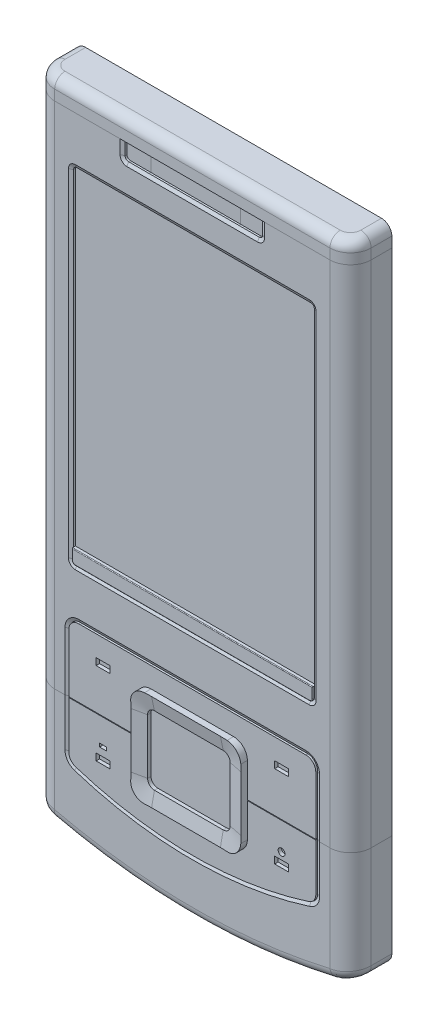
SolidWorks part; units mm, degrees
ref_plane "Front Plane" through (0, 0, 0) normal (0, 0, 1) x (1, 0, 0)
ref_plane "Top Plane" through (0, 0, 0) normal (0, 1, 0) x (1, 0, 0)
ref_plane "Right Plane" through (0, 0, 0) normal (1, 0, 0) x (0, 0, -1)
sketch "Sketch1" plane through (0, 0, 0) normal (0, 0, 1) x (1, 0, 0)
  line L0 (0, -93) -> (46, -93) construction
  line L1 (0, 0) -> (46, 0)
  line L2 (0, 0) -> (0, -93)
  line L3 (23, -96) -> (23, 0) construction
  line L4 (46, 0) -> (46, -93)
  arc A0 (0, -93) -> (46, -93) centre (23, -6.3333) ccw
  point P1 (46, -96)
  point P2 (0, -96)
  dimension "D1" = 46
  dimension "D2" = 96
  dimension "D3" = 3
extrude "Extrude1" add sketch "Sketch1" along normal blind 6
sketch "Sketch2" plane through (0, 0, 6) normal (0, 0, 1) x (1, 0, 0)
  line L0 (0, -3) -> (46, -3)
  line L1 (0, 0) -> (0, -93) construction
  line L2 (46, -93) -> (46, 0) construction
  line L3 (0, -77) -> (46, -77)
  line L4 (46, 0) -> (0, 0) construction
  arc A0 (0, -93) -> (46, -93) centre (23, -6.3333) ccw construction
  point P8 (23, -96)
  dimension "D1" = 19
  dimension "D2" = 3
split "Split1" trim tools "Sketch2" bodies to split 101 resulting bodies 102 103 104
sketch "Sketch3" plane through (0, 0, 6) normal (0, 0, 1) x (1, 0, 0)
  line L0 (0, -3) -> (0, -77) construction
  line L1 (6.5, -67) -> (39.5, -67)
  line L2 (5, -68.5) -> (5, -83.9174)
  line L3 (23, -77) -> (23, -88) construction
  line L4 (41, -68.5) -> (41, -83.9174)
  line L6 (0, -77) -> (46, -77) construction
  line L7 (5, -85) -> (41, -85) construction
  line L8 (0, -77) -> (46, -77) construction
  arc A0 (6.0417, -85.3457) -> (39.9583, -85.3457) centre (23, -32.5) ccw
  arc A1 (6.5, -67) -> (5, -68.5) centre (6.5, -68.5) ccw
  arc A2 (6.0417, -85.3457) -> (5, -83.9174) centre (6.5, -83.9174) cw
  arc A3 (39.9583, -85.3457) -> (41, -83.9174) centre (39.5, -83.9174) ccw
  arc A4 (39.5, -67) -> (41, -68.5) centre (39.5, -68.5) cw
  point P1 (41, -88)
  point P2 (5, -88)
  point P17 (5, -67)
  point P26 (41, -67)
  dimension "D3" = 11
  dimension "D6" = 1.5
  dimension "D1" = 36
  dimension "D2" = 5
  dimension "D4" = 10
  dimension "D5" = 3
extrude "Extrude2" cut sketch "Sketch3" against normal blind 2
sketch "Sketch5" plane through (0, 0, 4) normal (0, 0, 1) x (1, 0, 0)
  line L39 (40.95, -76.95) -> (40.95, -68.5)
  line L40 (39.5, -67.05) -> (6.5, -67.05)
  line L41 (5.05, -68.5) -> (5.05, -76.95)
  line L42 (5.05, -76.95) -> (40.95, -76.95)
  line L43 (40.95, -76.95) -> (40.95, -68.5)
  line L44 (39.5, -67.05) -> (6.5, -67.05)
  line L45 (5.05, -68.5) -> (5.05, -76.95)
  line L46 (5.05, -76.95) -> (40.95, -76.95)
  line L49 (40.95, -77.05) -> (5.05, -77.05)
  line L50 (5.05, -77.05) -> (5.05, -83.9174)
  line L51 (40.95, -83.9174) -> (40.95, -77.05)
  line L52 (40.95, -77.05) -> (5.05, -77.05)
  line L53 (5.05, -77.05) -> (5.05, -83.9174)
  line L54 (40.95, -83.9174) -> (40.95, -77.05)
  arc A2 (40.95, -68.5) -> (39.5, -67.05) centre (39.5, -68.5) ccw
  arc A3 (40.95, -68.5) -> (39.5, -67.05) centre (39.5, -68.5) ccw
  arc A4 (6.0569, -85.2981) -> (39.9431, -85.2981) centre (23, -32.5) ccw
  arc A5 (6.0569, -85.2981) -> (39.9431, -85.2981) centre (23, -32.5) ccw
  arc A6 (6.5, -67.05) -> (5.05, -68.5) centre (6.5, -68.5) ccw
  arc A7 (6.5, -67.05) -> (5.05, -68.5) centre (6.5, -68.5) ccw
  arc A9 (5.05, -83.9174) -> (6.0569, -85.2981) centre (6.5, -83.9174) ccw
  arc A10 (5.05, -83.9174) -> (6.0569, -85.2981) centre (6.5, -83.9174) ccw
  arc A11 (39.9431, -85.2981) -> (40.95, -83.9174) centre (39.5, -83.9174) ccw
  arc A12 (39.9431, -85.2981) -> (40.95, -83.9174) centre (39.5, -83.9174) ccw
  dimension "D1" = 0.05
  dimension "D2" = 0.05
extrude "Extrude3" add sketch "Sketch5" along normal blind 2 separate body
sketch "Sketch6" plane through (0, 0, 6) normal (0, 0, 1) x (1, 0, 0)
  line L0 (5, -77) -> (5, -83.9174) construction
  line L1 (17, -70) -> (29, -70)
  line L2 (15, -72) -> (15, -82)
  line L3 (17, -84) -> (29, -84)
  line L4 (31, -72) -> (31, -82)
  line L5 (41, -83.9174) -> (41, -77) construction
  line L6 (39.5, -67) -> (6.5, -67) construction
  arc A0 (6.0417, -85.3457) -> (39.9583, -85.3457) centre (23, -32.5) ccw construction
  arc A1 (17, -70) -> (15, -72) centre (17, -72) ccw
  arc A2 (29, -70) -> (31, -72) centre (29, -72) cw
  arc A3 (29, -84) -> (31, -82) centre (29, -82) ccw
  arc A4 (15, -82) -> (17, -84) centre (17, -82) ccw
  point P10 (23, -88)
  dimension "D5" = 2
  dimension "D1" = 10
  dimension "D2" = 10
  dimension "D3" = 3
  dimension "D4" = 4
extrude "Extrude4" cut sketch "Sketch6" against normal blind 2
sketch "Sketch7" plane through (0, 0, 4) normal (0, 0, 1) x (1, 0, 0)
  line L1 (29, -70) -> (17, -70) construction
  line L2 (29, -70) -> (17, -70)
  line L3 (17, -84) -> (29, -84)
  line L4 (31, -82) -> (31, -72)
  line L5 (15, -72) -> (15, -82)
  line L6 (18, -72) -> (28, -72)
  line L7 (17, -73) -> (17, -81)
  line L8 (18, -82) -> (28, -82)
  line L9 (29, -73) -> (29, -81)
  arc A0 (17, -70) -> (15, -72) centre (17, -72) ccw construction
  arc A1 (17, -70) -> (15, -72) centre (17, -72) ccw
  arc A2 (31, -72) -> (29, -70) centre (29, -72) ccw construction
  arc A3 (31, -72) -> (29, -70) centre (29, -72) ccw
  arc A4 (15, -82) -> (17, -84) centre (17, -82) ccw construction
  arc A5 (15, -82) -> (17, -84) centre (17, -82) ccw
  arc A6 (29, -84) -> (31, -82) centre (29, -82) ccw construction
  arc A7 (29, -84) -> (31, -82) centre (29, -82) ccw
  arc A8 (18, -72) -> (17, -73) centre (18, -73) ccw
  arc A9 (28, -72) -> (29, -73) centre (28, -73) cw
  arc A10 (28, -82) -> (29, -81) centre (28, -81) ccw
  arc A11 (17, -81) -> (18, -82) centre (18, -81) ccw
  dimension "D1" = 1
extrude "Extrude5" add sketch "Sketch7" along normal blind 3 separate body
sketch "Sketch8" plane through (0, 0, 4) normal (0, 0, 1) x (1, 0, 0)
  line L0 (18, -72) -> (28, -72)
  line L1 (29, -73) -> (29, -81)
  line L2 (28, -82) -> (18, -82)
  line L3 (17, -81) -> (17, -73)
  line L4 (17, -73) -> (17, -81) construction
  line L5 (18, -82) -> (28, -82) construction
  line L6 (29, -81) -> (29, -73) construction
  line L7 (28, -72) -> (18, -72) construction
  arc A0 (18, -72) -> (17, -73) centre (18, -73) ccw
  arc A1 (18, -82) -> (17, -81) centre (18, -81) cw
  arc A2 (29, -81) -> (28, -82) centre (28, -81) cw
  arc A3 (28, -72) -> (29, -73) centre (28, -73) cw
  point P10 (17, -72)
  point P13 (17, -82)
  point P16 (29, -82)
  point P19 (29, -72)
  dimension "D1" = 1
extrude "Extrude6" add sketch "Sketch8" along normal blind 2 separate body
sketch "Sketch9" plane through (0, 0, 6) normal (0, 0, 1) x (1, 0, 0)
  line L0 (9.025, -70.05) -> (11.025, -70.05)
  line L1 (9.025, -83.05) -> (11.025, -83.05)
  line L6 (36.975, -83.05) -> (34.975, -83.05)
  line L15 (36.975, -70.05) -> (34.975, -70.05)
  line L19 (10.025, -76.95) -> (10.025, -67.05) construction
  line L20 (5.05, -76.95) -> (15, -76.95) construction
  line L21 (39.5, -67.05) -> (6.5, -67.05) construction
  line L22 (10.025, -77.05) -> (10.025, -86.462) construction
  line L23 (15, -77.05) -> (5.05, -77.05) construction
  line L24 (35.975, -76.95) -> (35.975, -67.05) construction
  line L25 (31, -76.95) -> (40.95, -76.95) construction
  line L26 (35.975, -77.05) -> (35.975, -86.4106) construction
  line L27 (40.95, -77.05) -> (31, -77.05) construction
  line L28 (9.025, -82.05) -> (11.025, -82.05)
  line L30 (36.975, -82.05) -> (34.975, -82.05)
  line L31 (9.025, -82.05) -> (9.025, -83.05)
  line L34 (9.025, -71.05) -> (11.025, -71.05)
  line L35 (34.975, -82.05) -> (34.975, -83.05)
  line L36 (11.025, -82.05) -> (11.025, -83.05)
  line L37 (36.975, -71.05) -> (34.975, -71.05)
  line L38 (11.025, -71.05) -> (11.025, -70.05)
  line L39 (36.975, -71.05) -> (36.975, -70.05)
  line L40 (36.975, -82.05) -> (36.975, -83.05)
  line L41 (9.025, -71.05) -> (9.025, -70.05)
  line L42 (34.975, -71.05) -> (34.975, -70.05)
  line L43 (9.525, -81.05) -> (10.525, -81.05)
  line L44 (5.05, -71.05) -> (15, -71.05) construction
  line L45 (5.05, -70.05) -> (15, -70.05) construction
  line L46 (9.025, -76.95) -> (9.025, -67.05) construction
  line L47 (11.025, -76.95) -> (11.025, -67.05) construction
  line L48 (40.95, -70.05) -> (31, -70.05) construction
  line L49 (40.95, -71.05) -> (31, -71.05) construction
  line L50 (36.975, -76.95) -> (36.975, -67.05) construction
  line L51 (34.975, -76.95) -> (34.975, -67.05) construction
  line L52 (11.025, -77.05) -> (11.025, -86.462) construction
  line L53 (9.025, -77.05) -> (9.025, -86.462) construction
  line L56 (40.95, -83.05) -> (31, -83.05) construction
  line L57 (40.95, -82.05) -> (31, -82.05) construction
  line L58 (34.975, -77.05) -> (34.975, -86.4106) construction
  line L59 (36.975, -77.05) -> (36.975, -86.4106) construction
  line L61 (9.525, -80.55) -> (10.525, -80.55)
  line L62 (9.525, -80.55) -> (9.525, -81.05)
  line L63 (10.525, -80.55) -> (10.525, -81.05)
  line L65 (9.525, -77.05) -> (9.525, -86.462) construction
  line L66 (9.025, -80.55) -> (11.025, -80.55) construction
  line L67 (9.025, -81.05) -> (11.025, -81.05) construction
  line L70 (10.525, -77.05) -> (10.525, -86.462) construction
  arc A0 (6.0417, -85.3457) -> (39.9583, -85.3457) centre (23, -32.5) ccw construction
  arc A1 (6.0569, -85.2981) -> (39.9431, -85.2981) centre (23, -32.5) ccw construction
  circle A2 centre (35.975, -81.05) radius 0.5
  point P16 (5.05, -83.05)
  point P17 (15, -83.05)
  point P24 (5.05, -82.05)
  point P25 (15, -82.05)
  dimension "D18" = 1
  dimension "D19" = 1
  dimension "D3" = 3
  dimension "D4" = 3
  dimension "D1" = 6
  dimension "D2" = 1
  dimension "D9" = 6
  dimension "D5" = 1
  dimension "D6" = 1
  dimension "D7" = 1
  dimension "D8" = 1
  dimension "D10" = 1
  dimension "D11" = 1
  dimension "D12" = 1
  dimension "D13" = 1
  dimension "D15" = 0.5
  dimension "D16" = 0.5
  dimension "D17" = 0.5
extrude "Extrude7" cut sketch "Sketch9" against normal blind 0.5
sketch "Sketch10" plane through (0, 0, 6) normal (0, 0, 1) x (1, 0, 0)
  line L0 (0, -3) -> (46, -3) construction
  line L1 (13, -3) -> (33, -3)
  line L2 (13, -3) -> (13, -5)
  line L3 (13.5, -5.5) -> (32.5, -5.5)
  line L4 (33, -3) -> (33, -5)
  line L5 (0, -3) -> (0, -77) construction
  arc A0 (13, -5) -> (13.5, -5.5) centre (13.5, -5) ccw
  arc A1 (32.5, -5.5) -> (33, -5) centre (32.5, -5) ccw
  point P10 (13, -5.5)
  point P13 (33, -5.5)
  dimension "D4" = 0.5
  dimension "D1" = 2.5
  dimension "D2" = 20
  dimension "D3" = 13
extrude "Extrude8" cut sketch "Sketch10" against normal blind 0.5
sketch "Sketch12" plane through (0, 0, 5.5) normal (0, 0, 1) x (1, 0, 0)
  line L0 (13, -3) -> (13, -5) construction
  line L1 (13, -3) -> (13, -5)
  line L2 (13.5, -5.5) -> (16.5, -5.5)
  line L3 (13.5, -5.5) -> (32.5, -5.5) construction
  line L4 (16.5, -5.5) -> (16.5, -3)
  line L5 (33, -3) -> (13, -3) construction
  line L6 (16.5, -3) -> (13, -3)
  line L7 (33, -5) -> (33, -3) construction
  line L8 (33, -5) -> (33, -3)
  line L9 (33, -3) -> (29.5, -3)
  line L10 (0, -3) -> (46, -3) construction
  line L11 (29.5, -3) -> (29.5, -5.5)
  line L12 (13.5, -5.5) -> (32.5, -5.5) construction
  line L13 (29.5, -5.5) -> (32.5, -5.5)
  arc A0 (13, -5) -> (13.5, -5.5) centre (13.5, -5) ccw construction
  arc A1 (13, -5) -> (13.5, -5.5) centre (13.5, -5) ccw
  arc A2 (32.5, -5.5) -> (33, -5) centre (32.5, -5) ccw construction
  arc A3 (32.5, -5.5) -> (33, -5) centre (32.5, -5) ccw
  dimension "D1" = 3.5
  dimension "D2" = 3.5
extrude "Extrude9" cut sketch "Sketch12" against normal blind 2
sketch "Sketch13" plane through (0, 0, 3.5) normal (0, 0, 1) x (1, 0, 0)
  line L0 (16.5, -3) -> (13, -3) construction
  line L1 (16.5, -5.5) -> (16.5, -3) construction
  line L2 (33, -3) -> (29.5, -3) construction
  line L3 (29.5, -3) -> (29.5, -5.5) construction
  circle A0 centre (14.75, -4.25) radius 1
  circle A1 centre (31.25, -4.25) radius 1
  dimension "D1" = 2
  dimension "D2" = 1.25
  dimension "D3" = 1.75
  dimension "D4" = 2
  dimension "D5" = 1.25
  dimension "D6" = 1.75
extrude "Extrude10" add sketch "Sketch13" along normal blind 1 separate body
sketch "Sketch14" plane through (0, 0, 4.5) normal (0, 0, 1) x (1, 0, 0)
  line L0 (13, -3) -> (16.5, -3)
  line L1 (16.5, -3) -> (16.5, -5.5)
  line L2 (16.5, -5.5) -> (13.5, -5.5)
  line L3 (13, -5) -> (13, -3)
  line L4 (32.5, -5.5) -> (29.5, -5.5)
  line L5 (29.5, -5.5) -> (29.5, -3)
  line L6 (29.5, -3) -> (33, -3)
  line L7 (33, -3) -> (33, -5)
  arc A0 (13.5, -5.5) -> (13, -5) centre (13.5, -5) cw
  arc A1 (33, -5) -> (32.5, -5.5) centre (32.5, -5) cw
extrude "Extrude11" add sketch "Sketch14" along normal blind 1 separate body
chamfer "Chamfer1" distance 0.5 angle 25 10 edges at (41, -72.75, 6) (5, -72.75, 6) (40.5607, -67.4393, 6) (5.4393, -67.4393, 6) (23, -67, 6) (33, -4, 6) (32.8536, -5.3536, 6) (23, -5.5, 6) (13.1464, -5.3536, 6) (13, -4, 6)
chamfer "Chamfer2" distance 0.5 angle 25 5 edges at (41, -80.4587, 6) (40.7119, -84.8013, 6) (23, -88, 6) (5.2881, -84.8013, 6) (5, -80.4587, 6)
sketch "Sketch15" plane through (0, 0, 6) normal (0, 0, 1) x (1, 0, 0)
  line L0 (46, 0) -> (0, 0) construction
  line L1 (6, -10) -> (40, -10)
  line L2 (5.5, -10.5) -> (5.5, -59.5)
  line L3 (6, -60) -> (40, -60)
  line L4 (40.5, -10.5) -> (40.5, -59.5)
  line L5 (0, -3) -> (0, -77) construction
  arc A0 (6, -10) -> (5.5, -10.5) centre (6, -10.5) ccw
  arc A1 (40, -10) -> (40.5, -10.5) centre (40, -10.5) cw
  arc A2 (40, -60) -> (40.5, -59.5) centre (40, -59.5) ccw
  arc A3 (5.5, -59.5) -> (6, -60) centre (6, -59.5) ccw
  point P10 (5.5, -10)
  point P13 (40.5, -10)
  point P18 (5.5, -60)
  dimension "D5" = 0.5
  dimension "D1" = 50
  dimension "D2" = 35
  dimension "D3" = 10
  dimension "D4" = 5.5
extrude "Extrude12" cut sketch "Sketch15" against normal blind 1
sketch "Sketch16" plane through (0, 0, 5) normal (0, 0, 1) x (1, 0, 0)
  line L4 (5.5, -10.5) -> (5.5, -59.5)
  line L5 (6, -60) -> (40, -60)
  line L6 (40.5, -59.5) -> (40.5, -10.5)
  line L7 (40, -10) -> (6, -10)
  line L8 (5.5, -10.5) -> (5.5, -59.5)
  line L9 (6, -60) -> (40, -60)
  line L10 (40.5, -59.5) -> (40.5, -10.5)
  line L11 (40, -10) -> (6, -10)
  arc A4 (6, -10) -> (5.5, -10.5) centre (6, -10.5) ccw
  arc A5 (6, -10) -> (5.5, -10.5) centre (6, -10.5) ccw
  arc A6 (5.5, -59.5) -> (6, -60) centre (6, -59.5) ccw
  arc A7 (5.5, -59.5) -> (6, -60) centre (6, -59.5) ccw
  arc A8 (40, -60) -> (40.5, -59.5) centre (40, -59.5) ccw
  arc A9 (40, -60) -> (40.5, -59.5) centre (40, -59.5) ccw
  arc A10 (40.5, -10.5) -> (40, -10) centre (40, -10.5) ccw
  arc A11 (40.5, -10.5) -> (40, -10) centre (40, -10.5) ccw
  dimension "D1" = 0
extrude "Extrude13" add sketch "Sketch16" along normal blind 0.5 separate body
chamfer "Chamfer3" distance 0.5 angle 25 8 edges at (23, -60, 6) (40.5, -35, 6) (23, -10, 6) (5.5, -35, 6) (40.3536, -10.1464, 6) (40.3536, -59.8536, 6) (5.6464, -10.1464, 6) (5.6464, -59.8536, 6)
sketch "Sketch17" plane through (0, 0, 5.5) normal (0, 0, 1) x (1, 0, 0)
  line L0 (5.5, -59.5) -> (5.5, -58)
  line L1 (5.5, -10.5) -> (5.5, -59.5) construction
  line L2 (5.5, -58) -> (40.5, -58)
  line L3 (40.5, -59.5) -> (40.5, -10.5) construction
  line L4 (40.5, -58) -> (40.5, -59.5)
  line L5 (40, -60) -> (6, -60)
  arc A0 (5.5, -59.5) -> (6, -60) centre (6, -59.5) ccw construction
  arc A1 (5.5, -59.5) -> (6, -60) centre (6, -59.5) ccw
  arc A2 (40.5, -59.5) -> (40, -60) centre (40, -59.5) cw
  dimension "D1" = 2
extrude "Extrude14" add sketch "Sketch17" along normal blind 0.5 separate body
fillet "Fillet1" radius 0.1 6 edges at (5.5, -58.75, 6) (23, -58, 6) (40.5, -58.75, 6) (40.3536, -59.8536, 6) (23, -60, 6) (5.6464, -59.8536, 6)
chamfer "Chamfer5" distance 0.5 angle 78.25 4 edges at (28.7071, -81.7071, 7) (17.2929, -81.7071, 7) (28.7071, -72.2929, 7) (17.2929, -72.2929, 7)
fillet "Fillet2" radius 3 2 edges at (46, -40, 6) (0, -40, 6)
fillet "Fillet3" radius 3 2 edges at (46, -1.5, 6) (0, -1.5, 6)
fillet "Fillet4" radius 3 2 edges at (46, -85, 6) (0, -85, 6)
fillet "Fillet5" radius 1.5 5 edges at (46, 0, 1.5) (45.1213, 0, 5.1213) (0, 0, 1.5) (0.8787, 0, 5.1213) (23, 0, 6)
fillet "Fillet6" radius 1.5 5 edges at (0, -93, 1.5) (1.0851, -93.2807, 5.3094) (46, -93, 1.5) (45.3783, -93.1626, 4.8286) (23, -96, 6)
ref_plane "Plane1" through (0, -96, 0) normal (0, 1, 0) x (-1, 0, 0)
sketch "Sketch19" plane through (0, -96, 0) normal (0, 1, 0) x (-1, 0, 0)
  line L0 (-44.5, 0) -> (-1.5, 0) construction
  line L1 (-43, 0) -> (-3, 0)
  line L3 (-41, 1.5) -> (-5, 1.5)
  arc A0 (-43, 0) -> (-41, 1.5) centre (-40.9875, -0.6) cw
  arc A1 (-5, 1.5) -> (-3, 0) centre (-5.0125, -0.6) cw
  dimension "D4" = 2
  dimension "D2" = 2.1
  dimension "D7" = 2.1
  dimension "D1" = 3
  dimension "D3" = 1.5
  dimension "D5" = 2
  dimension "D6" = 3
extrude "Extrude17" cut sketch "Sketch19" along normal blind 81
